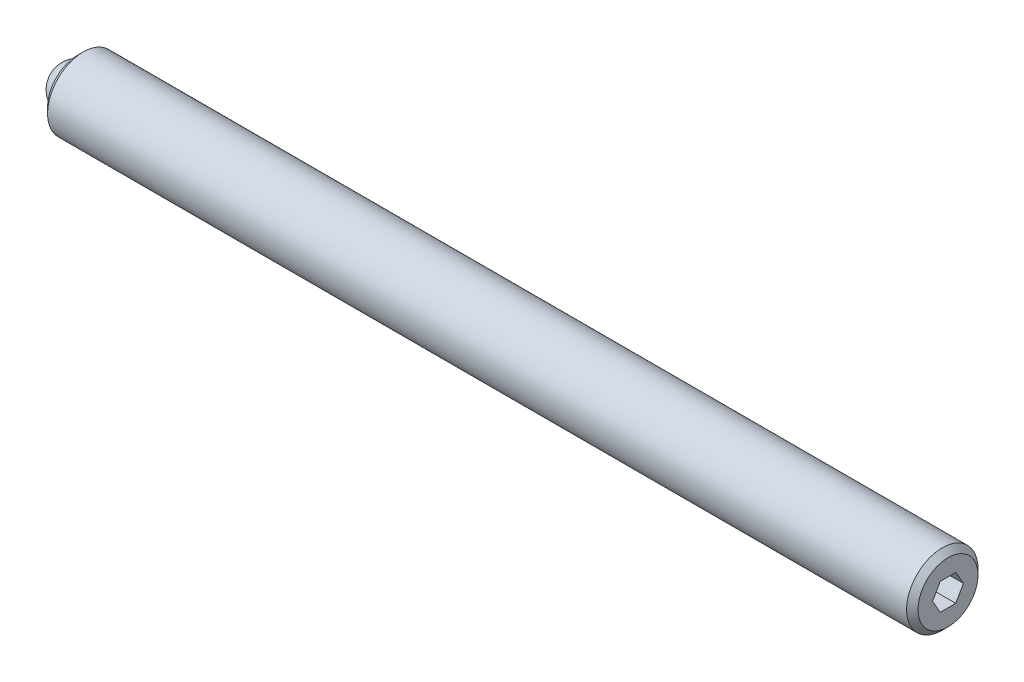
SolidWorks part; units mm, degrees
ref_plane "Front Plane" through (0, 0, 0) normal (0, 0, 1) x (1, 0, 0)
ref_plane "Top Plane" through (0, 0, 0) normal (0, 1, 0) x (1, 0, 0)
ref_plane "Right Plane" through (0, 0, 0) normal (1, 0, 0) x (0, 0, -1)
sketch "Sketch2" plane through (0, 0, 0) normal (1, 0, 0) x (0, 0, -1)
  circle A0 centre (0, 0) radius 3.175
  dimension "D1" = 6.35
extrude "Boss-Extrude1" add sketch "Sketch2" along normal blind 77.3906
sketch "Sketch3" plane through (0, 0, 0) normal (-1, 0, 0) x (0, 0, 1)
  circle A0 centre (0, 0) radius 1.9812
  dimension "D1" = 3.9624
chamfer "Chamfer1" distance 0.508 angle 45 1 edges at (0, 0, -3.175)
chamfer "Chamfer2" distance 0.508 angle 45 1 edges at (77.3906, 0, -3.175)
sketch "Sketch4" plane through (77.3906, 0, 0) normal (1, 0, 0) x (0, 0, -1)
  line L1 (1.3748, 0) -> (0.6874, 1.1906)
  line L2 (0.6874, 1.1906) -> (-0.6874, 1.1906)
  line L3 (-0.6874, 1.1906) -> (-1.3748, 0)
  line L4 (-1.3748, 0) -> (-0.6874, -1.1906)
  line L5 (-0.6874, -1.1906) -> (0.6874, -1.1906)
  line L6 (0.6874, -1.1906) -> (1.3748, 0)
  circle A0 centre (0, 0) radius 1.1906 construction
  dimension "D1" = 2.3813
extrude "Cut-Extrude2" cut sketch "Sketch4" against normal blind 2.286
extrude "Cut-Extrude3" cut sketch "Sketch3" against normal blind 1.9844
sketch "Sketch5" plane through (0, 0, 0) normal (-1, 0, 0) x (0, 0, 1)
  line L0 (0, 0) -> (0, -1.9844)
  line L1 (0, 0) -> (0, 1.9844)
  arc A0 (0, 1.9844) -> (0, -1.9844) centre (0, 0) ccw
  dimension "D1" = 1.9844
revolve "Revolve1" add sketch "Sketch5" angle 360 about L1
